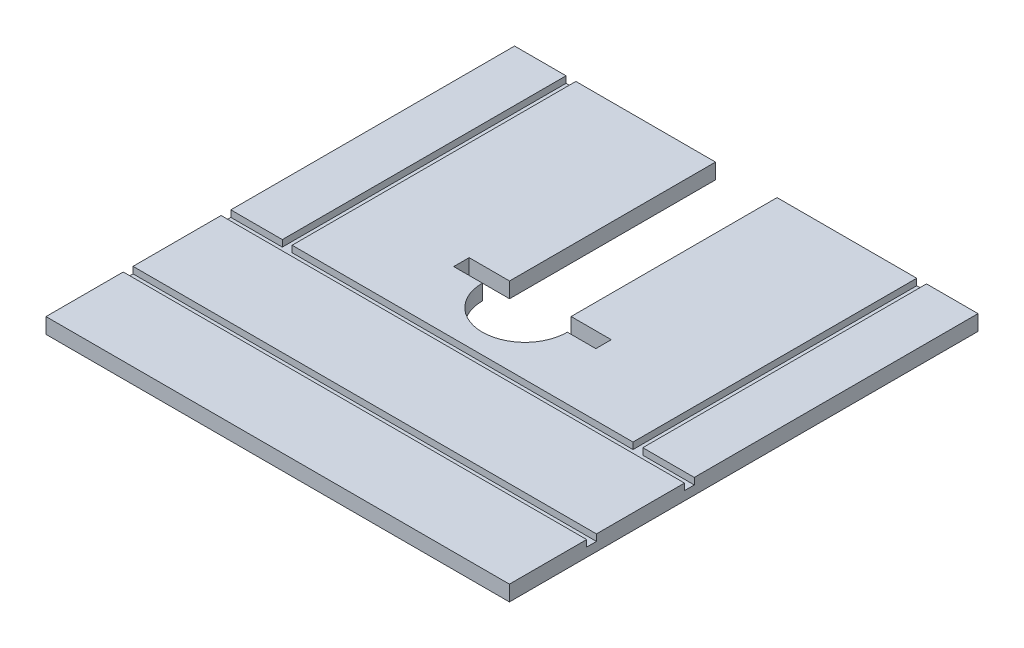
SolidWorks part; units mm, degrees
ref_plane "Front Plane" through (0, 0, 0) normal (0, 0, 1) x (1, 0, 0)
ref_plane "Top Plane" through (0, 0, 0) normal (0, 1, 0) x (1, 0, 0)
ref_plane "Right Plane" through (0, 0, 0) normal (1, 0, 0) x (0, 0, -1)
sketch "Sketch2" plane through (0, 0, 0) normal (0, 1, 0) x (1, 0, 0)
  line L0 (-59.7766, 430) -> (-450, 430)
  line L1 (450, 430) -> (59.7766, 430)
  line L2 (450, 430) -> (450, -480)
  line L3 (450, -480) -> (-450, -480)
  line L4 (-450, 430) -> (-450, -480)
  line L7 (-59.7766, 30) -> (-138.2234, 30)
  line L8 (-59.7766, 430) -> (-59.7766, 30)
  line L9 (-138.2234, 30) -> (-138.2234, 0)
  line L10 (59.7766, 430) -> (59.7766, 30)
  line L11 (-138.2234, 0) -> (137.7766, 0) construction
  line L12 (59.7766, 30) -> (137.7766, 30)
  line L13 (-59.7766, 30) -> (-67.7766, 30) construction
  line L14 (137.7766, 30) -> (137.7766, 0)
  line L15 (59.7766, 30) -> (67.7766, 30) construction
  line L16 (-138.2234, 0) -> (-82.5, 0)
  line L17 (137.7766, 0) -> (82.5, 0)
  arc A0 (-82.5, 0) -> (82.5, 0) centre (0, 0) ccw
  point P0 (0, 0)
  dimension "D1" = 82.5
extrude "Boss-Extrude1" add sketch "Sketch2" along normal blind 30
sketch "Sketch3" plane through (0, 30, 0) normal (0, 1, 0) x (1, 0, 0)
  line L0 (-450, -311) -> (450, -311)
  line L2 (-450, 430) -> (-450, -480) construction
  line L3 (450, -480) -> (450, 430) construction
  line L5 (450, -311) -> (450, -330)
  line L6 (450, -330) -> (-450, -330)
  line L7 (-450, -330) -> (-450, -311)
  line L8 (-450, -121) -> (-350, -121)
  line L9 (450, -121) -> (450, -140)
  line L10 (450, -140) -> (-450, -140)
  line L11 (-450, -140) -> (-450, -121)
  line L12 (0, 0) -> (0, 430) construction
  line L13 (0, 0) -> (0, -121) construction
  line L14 (0, -121) -> (0, -311) construction
  line L15 (0, 430) -> (-331, 430) construction
  line L16 (-59.7766, 430) -> (-450, 430) construction
  line L17 (0, 430) -> (331, 430) construction
  line L18 (450, 430) -> (59.7766, 430) construction
  line L19 (-331, -121) -> (-331, 430)
  line L20 (-331, 430) -> (-350, 430)
  line L21 (-350, 430) -> (-350, -121)
  line L22 (331, -121) -> (331, 430)
  line L23 (331, 430) -> (350, 430)
  line L24 (350, 430) -> (350, -121)
  line L25 (-331, -121) -> (331, -121)
  line L26 (350, -121) -> (450, -121)
extrude "Cut-Extrude1" cut sketch "Sketch3" against normal blind 12.7
